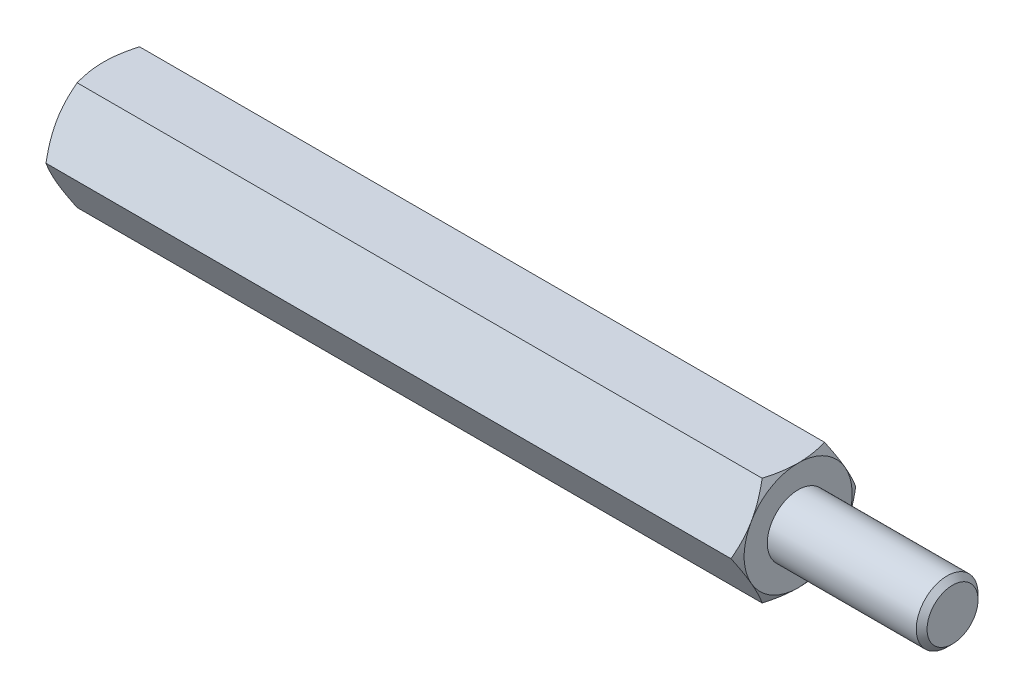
SolidWorks part; units mm, degrees
ref_plane "Front Plane" through (0, 0, 0) normal (0, 0, 1) x (1, 0, 0)
ref_plane "Top Plane" through (0, 0, 0) normal (0, 1, 0) x (1, 0, 0)
ref_plane "Right Plane" through (0, 0, 0) normal (1, 0, 0) x (0, 0, -1)
sketch "Sketch1" plane through (0, 0, 0) normal (1, 0, 0) x (0, 0, -1)
  line L1 (2.0207, 3.5) -> (-2.0207, 3.5)
  line L2 (-2.0207, 3.5) -> (-4.0415, 0)
  line L3 (-4.0415, 0) -> (-2.0207, -3.5)
  line L4 (-2.0207, -3.5) -> (2.0207, -3.5)
  line L5 (2.0207, -3.5) -> (4.0415, 0)
  line L6 (4.0415, 0) -> (2.0207, 3.5)
  circle A0 centre (0, 0) radius 3.5 construction
  dimension "D1" = 7
extrude "Extrude2" add sketch "Sketch1" along normal mid plane 45
sketch "Sketch2" plane through (0, 0, 0) normal (0, 0, 1) x (1, 0, 0)
  line L0 (-22.5, 3.5) -> (-21, 6.0981)
  line L1 (-22.5, 6.5) -> (-22.5, 3.5)
  line L3 (0, 0) -> (50000, 0) construction
  arc A0 (-21, 6.0981) -> (-22.5, 6.5) centre (-21.6962, 6.5) ccw
  dimension "D1" = 30
  dimension "D2" = 3
revolve "Cut-Revolve1" cut sketch "Sketch2" angle 360 about L3
mirror "Mirror1" about plane through (0, 0, 0) normal (1, 0, 0) of "Cut-Revolve1"
sketch "Sketch3" plane through (-22.5, 0, 0) normal (-1, 0, 0) x (0, 0, 1)
  circle A0 centre (0, 0) radius 1.65
  dimension "D1" = 3.3
extrude "Extrude3" cut sketch "Sketch3" against normal blind 10
sketch "Sketch4" plane through (0, 0, 0) normal (0, 0, 1) x (1, 0, 0)
  line L0 (-12.5, 0) -> (-12.5, 1.65)
  line L1 (22.1874, 0) -> (-22.1874, 0) construction
  line L2 (-12.5, 1.65) -> (-11.5474, 0)
  line L3 (-11.5474, 0) -> (-12.5, 0)
  line L4 (-22.5, 1.75) -> (-22.5, -1.75) construction
  point P4 (-22.5, 0)
  dimension "D1" = 30
  dimension "D2" = 1.65
  dimension "D3" = 10
revolve "Cut-Revolve2" cut sketch "Sketch4" angle 360 about L3
sketch "Sketch5" plane through (22.5, 0, 0) normal (1, 0, 0) x (0, 0, -1)
  circle A0 centre (0, 0) radius 2
  dimension "D1" = 4
extrude "Extrude4" add sketch "Sketch5" along normal blind 10
chamfer "Chamfer1" distance 0.35 angle 45 1 edges at (32.5, 0, -2)
equation "\"D2@Sketch4\" = \"D1@Sketch3\"/2"
